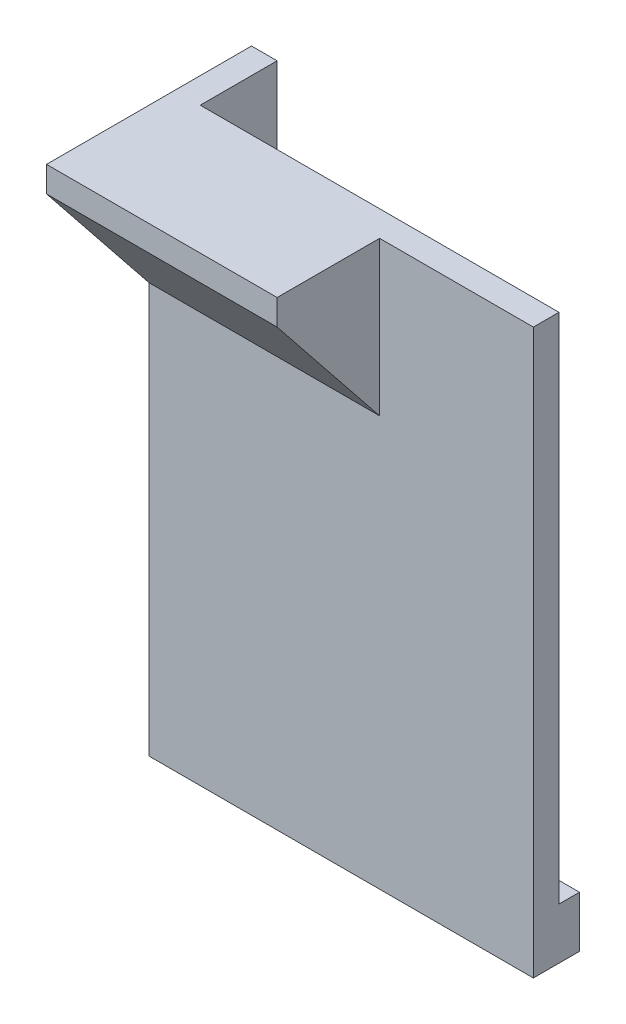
SolidWorks part; units mm, degrees
ref_plane "Vorne" through (0, 0, 0) normal (0, 0, 1) x (1, 0, 0)
ref_plane "Oben" through (0, 0, 0) normal (0, 1, 0) x (1, 0, 0)
ref_plane "Rechts" through (0, 0, 0) normal (1, 0, 0) x (0, 0, -1)
sketch "Skizze1" plane through (0, 0, 0) normal (0, 1, 0) x (1, 0, 0)
  line L0 (0, 15) -> (0, 0)
  line L1 (0, -90.1661) -> (0, 90.1661) construction
  line L2 (0, 0) -> (70, 0)
  dimension "D1" = 70
  dimension "D2" = 15
extrude "Linear-Austragen-Dünn1" add sketch "Skizze1" along normal blind 100 and the other way blind 10 thin
sketch "Skizze3" plane through (0, 0, 0) normal (1, 0, 0) x (0, 0, -1)
  line L0 (-5, 70) -> (-5, 100)
  line L1 (-5, 100) -> (-25, 100)
  line L2 (-25, 100) -> (-25, 95)
  line L3 (-25, 95) -> (-5, 70)
  line L4 (-5, -10) -> (-5, 100) construction
  line L5 (0, 100) -> (-5, 100) construction
  dimension "D1" = 5
  dimension "D2" = 30
  dimension "D3" = 20
extrude "Linear austragen2" add sketch "Skizze3" against normal through all and the other way offset from surface (40 mm away) 45
sketch "Skizze2" plane through (0, 0, 0) normal (0, 1, 0) x (1, 0, 0)
  line L0 (70, 0) -> (70, -5) construction
  line L1 (0, 4) -> (20, 4)
  line L2 (0, 4) -> (0, -5)
  line L3 (0, -5) -> (20, -5)
  line L4 (20, 4) -> (20, -5)
  line L5 (70, -5) -> (50, -5)
  line L6 (70, -5) -> (70, 4)
  line L7 (70, 4) -> (50, 4)
  line L8 (50, -5) -> (50, 4)
  line L9 (0, 0) -> (70, 0) construction
  line L10 (0, 15) -> (0, 0) construction
  line L11 (-5, -5) -> (70, -5) construction
  dimension "D1" = 30
  dimension "D2" = 4
extrude "Linear austragen3" add sketch "Skizze2" against normal up to surface (10 mm away)
